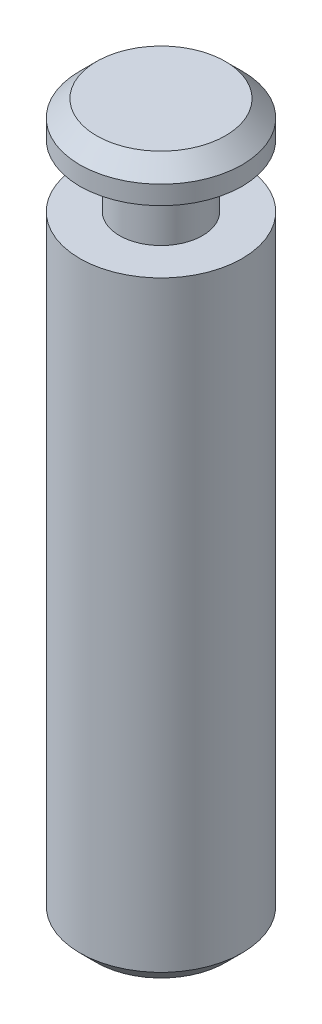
SolidWorks part; units mm, degrees
ref_plane "Front Plane" through (0, 0, 0) normal (0, 0, 1) x (1, 0, 0)
ref_plane "Top Plane" through (0, 0, 0) normal (0, 1, 0) x (1, 0, 0)
ref_plane "Right Plane" through (0, 0, 0) normal (1, 0, 0) x (0, 0, -1)
sketch "Sketch1" plane through (0, 0, 0) normal (0, 1, 0) x (1, 0, 0)
  circle A0 centre (0, 0) radius 5.5372
  dimension "D1" = 11.0744
extrude "Boss-Extrude1" add sketch "Sketch1" along normal blind 48.8442
chamfer "Chamfer1" distance 1.143 angle 45 2 edges at (0, 48.8442, 5.5372) (0, 0, 5.5372)
sketch "Sketch2" plane through (0, 0, 0) normal (1, 0, 0) x (0, 0, -1)
  line L0 (0, 0) -> (0, 50.4276) construction
  line L1 (4.3942, 48.8442) -> (-4.3942, 48.8442) construction
  line L2 (2.8321, 46.4312) -> (12.7, 46.4312)
  line L3 (2.8321, 46.4312) -> (2.8321, 42.164)
  line L4 (2.8321, 42.164) -> (12.7, 42.164)
  line L5 (12.7, 46.4312) -> (12.7, 42.164)
  dimension "D1" = 2.413
  dimension "D2" = 4.2672
  dimension "D3" = 5.6642
  dimension "D4" = 25.4
revolve "Cut-Revolve1" cut sketch "Sketch2" angle 360 about L0
